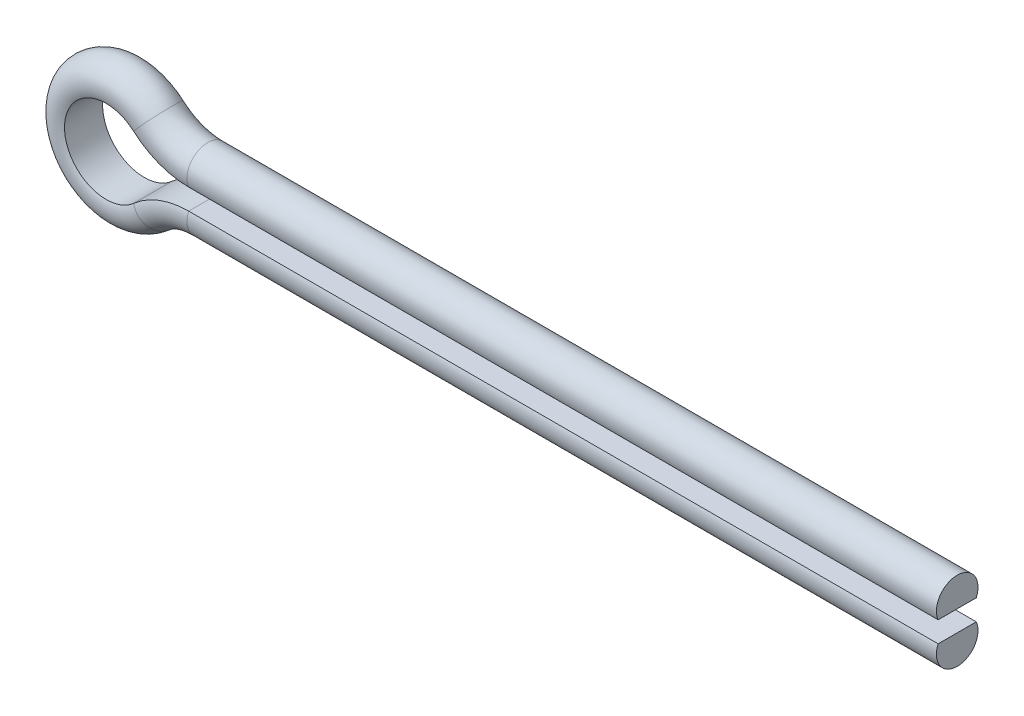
SolidWorks part; units mm, degrees
ref_plane "Front Plane" through (0, 0, 0) normal (0, 0, 1) x (1, 0, 0)
ref_plane "Top Plane" through (0, 0, 0) normal (0, 1, 0) x (1, 0, 0)
ref_plane "Right Plane" through (0, 0, 0) normal (1, 0, 0) x (0, 0, -1)
sketch "Sketch1" plane through (0, 0, 0) normal (0, 0, 1) x (1, 0, 0)
  line L0 (0, 0) -> (95.4276, 0) construction
  line L1 (100, 1.25) -> (9.9216, 1.25)
  line L2 (100, -1.25) -> (9.9216, -1.25)
  arc A0 (3.3072, 3.75) -> (3.3072, -3.75) centre (0, 0) ccw
  arc A1 (9.9216, 1.25) -> (3.3072, 3.75) centre (9.9216, 11.25) cw
  arc A2 (9.9216, -1.25) -> (3.3072, -3.75) centre (9.9216, -11.25) ccw
  point P9 (4.8412, 1.25)
  point P12 (4.8412, -1.25)
  dimension "D1" = 5
  dimension "D3" = 10
  dimension "D2" = 2.5
  dimension "D4" = 100
ref_plane "Plane1" through (100, 1.25, 0) normal (-1, 0, 0) x (0, 0, 1)
sketch "Sketch2" plane through (100, 1.25, 0) normal (-1, 0, 0) x (0, 0, 1)
  line L0 (-2.2913, 0) -> (2.2913, 0)
  arc A0 (2.2913, 0) -> (-2.2913, 0) centre (0, 1) ccw
  dimension "D1" = 2.5
  dimension "D2" = 3.5
sweep "Sweep1" add profiles "Sketch2" path "Sketch1"
